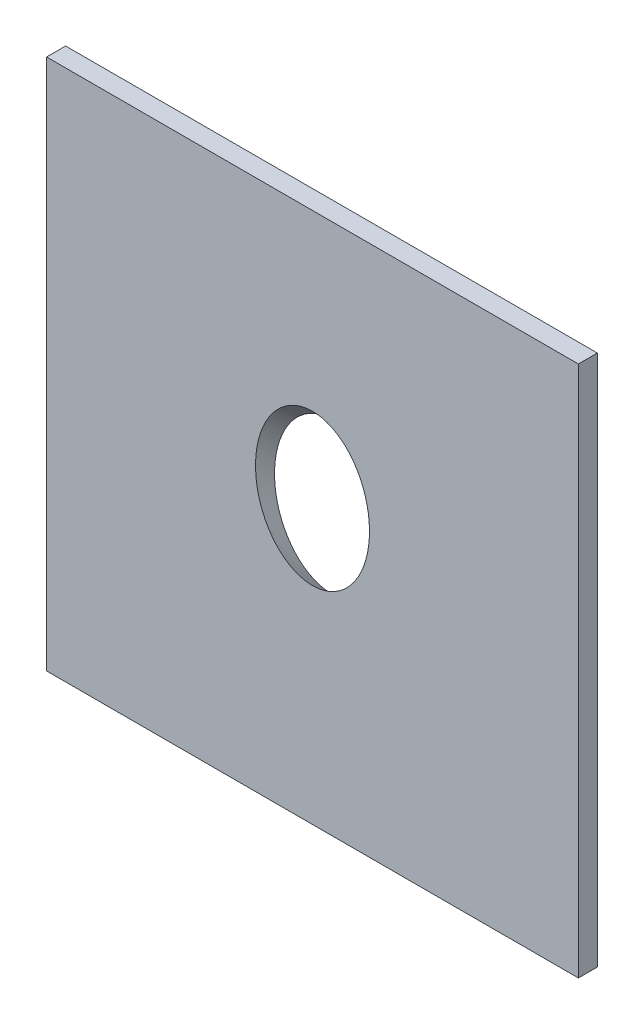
SolidWorks part; units mm, degrees
ref_plane "Front Plane" through (0, 0, 0) normal (0, 0, 1) x (1, 0, 0)
ref_plane "Top Plane" through (0, 0, 0) normal (0, 1, 0) x (1, 0, 0)
ref_plane "Right Plane" through (0, 0, 0) normal (1, 0, 0) x (0, 0, -1)
sketch "Sketch1" plane through (0, 0, 0) normal (0, 0, 1) x (1, 0, 0)
  line L1 (70, -70) -> (-70, -70)
  line L2 (70, -70) -> (70, 70)
  line L3 (70, 70) -> (-70, 70)
  line L4 (-70, -70) -> (-70, 70)
  line L5 (70, -70) -> (-70, 70) construction
  line L6 (70, 70) -> (-70, -70) construction
  point P0 (0, 0)
  dimension "D1" = 140
  dimension "D2" = 140
extrude "Boss-Extrude1" add sketch "Sketch1" along normal blind 5
other "Cavity1"
other "Handle<2>@Handle Assembly1"
surface "Surface-MidSurface1" parameters "D0"=50000
